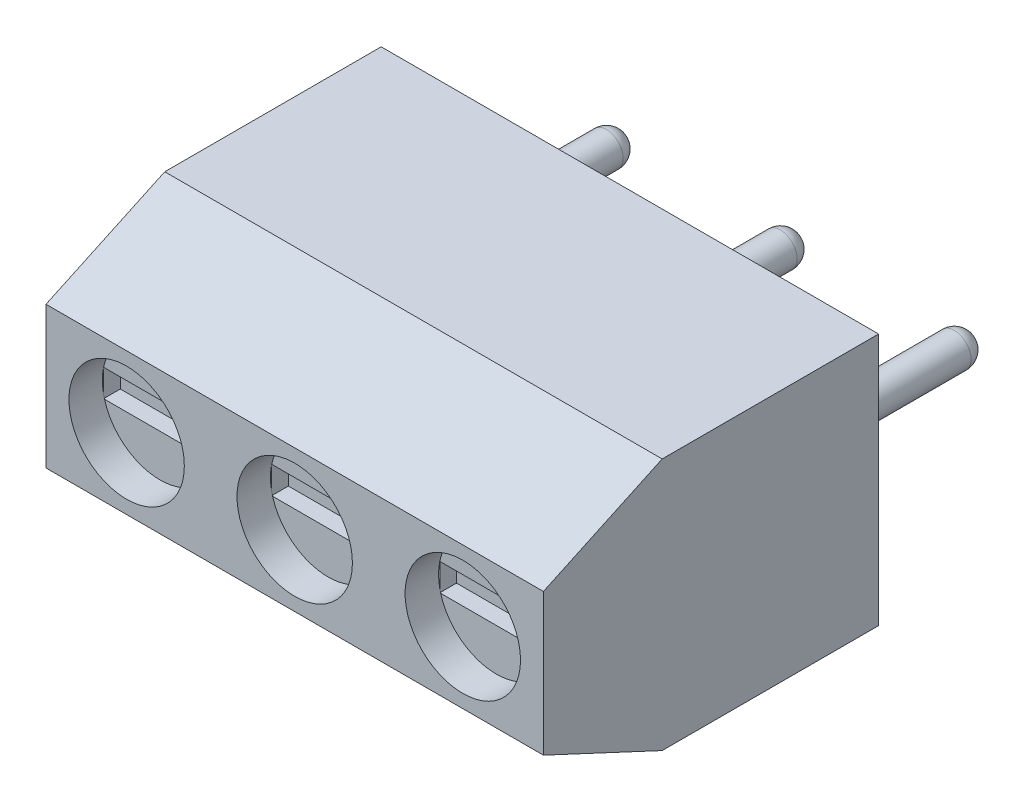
SolidWorks part; units mm, degrees
ref_plane "Face" through (0, 0, 0) normal (0, 0, 1) x (1, 0, 0)
ref_plane "Dessus" through (0, 0, 0) normal (0, 1, 0) x (1, 0, 0)
ref_plane "Droite" through (0, 0, 0) normal (1, 0, 0) x (0, 0, -1)
sketch "Esquisse1" plane through (0, 0, 0) normal (0, 0, 1) x (1, 0, 0)
  line L1 (0, 0) -> (14.87, 0)
  line L2 (0, 0) -> (0, 7.55)
  line L3 (0, 7.55) -> (14.87, 7.55)
  line L4 (14.87, 0) -> (14.87, 7.55)
  dimension "D1" = 14.87
  dimension "D2" = 7.55
extrude "Extrusion1" add sketch "Esquisse1" along normal blind 10.02
chamfer "Chanfrein1" distance 3.55 angle 25 2 edges at (7.435, 7.55, 10.02) (7.435, 0, 10.02)
sketch "Esquisse2" plane through (0, 0, 10.02) normal (0, 0, 1) x (1, 0, 0)
  line L0 (0, 3.775) -> (14.87, 3.775) construction
  line L1 (0, 5.8946) -> (0, 1.6554) construction
  line L2 (14.87, 1.6554) -> (14.87, 5.8946) construction
  line L3 (7.435, 5.8946) -> (7.435, 1.6554) construction
  line L4 (14.87, 5.8946) -> (0, 5.8946) construction
  line L5 (0, 1.6554) -> (14.87, 1.6554) construction
  circle A0 centre (2.4101, 3.775) radius 1.725
  circle A1 centre (12.4599, 3.775) radius 1.725
  circle A2 centre (7.435, 3.775) radius 1.725
  dimension "D1" = 3.45
extrude "Enlèv. mat.-Extru.1" cut sketch "Esquisse2" against normal blind 1
sketch "Esquisse3" plane through (0, 0, 0) normal (0, -1, 0) x (1, 0, 0)
  line L0 (0, 6.47) -> (0, 0) construction
  line L2 (0, 0) -> (14.87, 0) construction
  line L4 (9.44, 5.8) -> (5.44, 5.8)
  line L5 (9.44, 5.8) -> (9.44, 0.8)
  line L6 (9.44, 0.8) -> (5.44, 0.8)
  line L7 (5.44, 5.8) -> (5.44, 0.8)
  line L8 (4.54, 5.8) -> (0.54, 5.8)
  line L9 (4.54, 5.8) -> (4.54, 0.8)
  line L10 (4.54, 0.8) -> (0.54, 0.8)
  line L11 (0.54, 5.8) -> (0.54, 0.8)
  line L12 (10.34, 0.8) -> (14.34, 0.8)
  line L13 (10.34, 0.8) -> (10.34, 5.8)
  line L14 (10.34, 5.8) -> (14.34, 5.8)
  line L15 (14.34, 0.8) -> (14.34, 5.8)
  dimension "D1" = 5
  dimension "D2" = 4
  dimension "D3" = 0.8
  dimension "D4" = 0.9
  dimension "D5" = 0.54
  dimension "D6" = 4
  dimension "D7" = 5
  dimension "D8" = 0.9
extrude "Enlèv. mat.-Extru.2" cut sketch "Esquisse3" against normal blind 1.6
sketch "Esquisse4" plane through (0, 1.6, 0) normal (0, -1, 0) x (1, 0, 0)
  line L0 (14.87, 3.235) -> (0, 3.235) construction
  line L1 (14.87, 6.47) -> (14.87, 0) construction
  line L2 (0, 6.47) -> (0, 0) construction
  line L3 (7.44, 5.8) -> (7.44, 0.8) construction
  line L4 (9.44, 5.8) -> (5.44, 5.8) construction
  line L5 (5.44, 0.8) -> (9.44, 0.8) construction
  line L6 (2.54, 5.8) -> (2.54, 0.8) construction
  line L7 (4.54, 5.8) -> (0.54, 5.8) construction
  line L8 (0.54, 0.8) -> (4.54, 0.8) construction
  line L9 (12.34, 5.8) -> (12.34, 0) construction
  line L10 (14.34, 5.8) -> (10.34, 5.8) construction
  line L11 (0, 0) -> (14.87, 0) construction
  circle A0 centre (7.44, 3.235) radius 1.675
  circle A1 centre (2.535, 3.235) radius 1.675
  circle A2 centre (12.34, 3.235) radius 1.675
  dimension "D1" = 3.35
extrude "Enlèv. mat.-Extru.3" cut sketch "Esquisse4" against normal blind 1.6
sketch "Esquisse5" plane through (0, 0, 0) normal (0, 0, -1) x (-1, 0, 0)
  line L0 (-14.87, 3.775) -> (0, 3.775) construction
  line L1 (-14.87, 0) -> (-14.87, 7.55) construction
  line L2 (0, 7.55) -> (0, 0) construction
  line L3 (-7.435, 0) -> (-7.435, 7.55) construction
  line L6 (0, 0) -> (-14.87, 0) construction
  line L7 (-14.87, 7.55) -> (0, 7.55) construction
  circle A0 centre (-7.435, 3.775) radius 0.5
  circle A1 centre (-2.235, 3.775) radius 0.5
  circle A2 centre (-12.635, 3.775) radius 0.5
  dimension "D1" = 1
  dimension "D3" = 5.2
  dimension "D2" = 5.2
extrude "Extrusion2" add sketch "Esquisse5" along normal blind 5
fillet "Congé1" radius 0.5 3 edges at (6.935, 3.775, -5) (1.735, 3.775, -5) (12.135, 3.775, -5)
sketch "Esquisse7" plane through (0, 0, 9.02) normal (0, 0, 1) x (1, 0, 0)
  line L1 (0.721, 4.1248) -> (4.0715, 4.1248)
  line L2 (0.721, 4.1248) -> (0.721, 3.3107)
  line L3 (0.721, 3.3107) -> (4.0715, 3.3107)
  line L4 (4.0715, 4.1248) -> (4.0715, 3.3107)
  line L5 (9.0964, 3.3107) -> (5.7458, 3.3107)
  line L6 (9.0964, 3.3107) -> (9.0964, 4.1248)
  line L7 (9.0964, 4.1248) -> (5.7458, 4.1248)
  line L8 (5.7458, 3.3107) -> (5.7458, 4.1248)
  line L9 (10.7707, 4.1248) -> (14.1212, 4.1248)
  line L10 (10.7707, 4.1248) -> (10.7707, 3.3107)
  line L11 (10.7707, 3.3107) -> (14.1212, 3.3107)
  line L12 (14.1212, 4.1248) -> (14.1212, 3.3107)
  circle A0 centre (2.4101, 3.775) radius 1.725 construction
  circle A2 centre (7.435, 3.775) radius 1.725 construction
  circle A3 centre (12.4599, 3.775) radius 1.725 construction
extrude "Enlèv. mat.-Extru.4" cut sketch "Esquisse7" against normal blind 0.5
sketch "Esquisse8" plane through (0, 3.2, 0) normal (0, -1, 0) x (1, 0, 0)
  line L1 (0.9436, 3.7576) -> (4.1396, 3.7576)
  line L2 (0.9436, 3.7576) -> (0.9436, 2.7545)
  line L3 (0.9436, 2.7545) -> (4.1396, 2.7545)
  line L4 (4.1396, 3.7576) -> (4.1396, 2.7545)
  line L5 (7.9892, 4.8174) -> (6.8908, 4.8174)
  line L6 (7.9892, 4.8174) -> (7.9892, 1.6526)
  line L7 (7.9892, 1.6526) -> (6.8908, 1.6526)
  line L8 (6.8908, 4.8174) -> (6.8908, 1.6526)
  line L9 (10.7486, 3.7576) -> (13.9446, 3.7576)
  line L10 (10.7486, 3.7576) -> (10.7486, 2.7545)
  line L11 (10.7486, 2.7545) -> (13.9446, 2.7545)
  line L12 (13.9446, 3.7576) -> (13.9446, 2.7545)
  circle A0 centre (2.535, 3.235) radius 1.675 construction
  circle A1 centre (7.44, 3.235) radius 1.675 construction
  circle A2 centre (12.34, 3.235) radius 1.675 construction
extrude "Enlèv. mat.-Extru.5" cut sketch "Esquisse8" against normal blind 0.5
